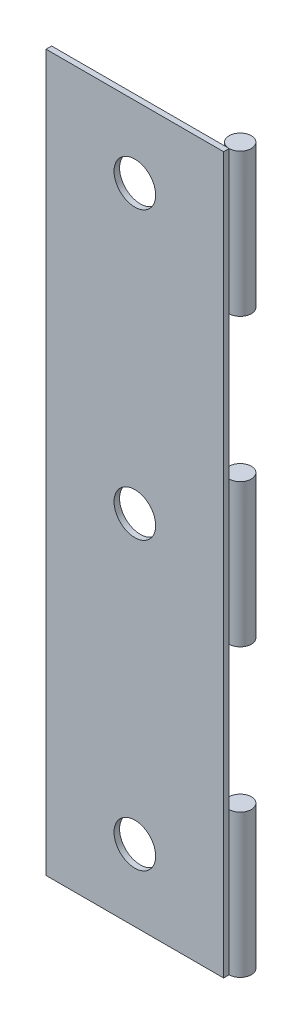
SolidWorks part; units mm, degrees
ref_plane "Front Plane" through (0, 0, 0) normal (0, 0, 1) x (1, 0, 0)
ref_plane "Top Plane" through (0, 0, 0) normal (0, 1, 0) x (1, 0, 0)
ref_plane "Right Plane" through (0, 0, 0) normal (1, 0, 0) x (0, 0, -1)
sketch "Sketch2" plane through (0, 0, 0) normal (0, 1, 0) x (1, 0, 0)
  circle A0 centre (0, 0) radius 1
extrude "Boss-Extrude1" add sketch "Sketch2" along normal blind 64.5
sketch "Sketch3" plane through (0, 0, 0) normal (0, 0, 1) x (1, 0, 0)
  line L0 (0, 64.5) -> (0, 51.6) construction
  line L1 (1, 64.5) -> (-1, 64.5) construction
  line L2 (0.0429, 38.7) -> (0.0429, 25.8) construction
  line L3 (-3.0046, 51.6) -> (3.0905, 51.6)
  line L4 (-3.0046, 51.6) -> (-3.0046, 38.7)
  line L5 (-3.0046, 38.7) -> (3.0905, 38.7)
  line L6 (3.0905, 51.6) -> (3.0905, 38.7)
  line L8 (-3.0046, 25.8) -> (3.0905, 25.8)
  line L9 (-3.0046, 25.8) -> (-3.0046, 12.9)
  line L10 (-3.0046, 12.9) -> (3.0905, 12.9)
  line L11 (3.0905, 25.8) -> (3.0905, 12.9)
  dimension "D1" = 12.9
  dimension "D2" = 12.9
extrude "Cut-Extrude1" cut sketch "Sketch3" against normal up to next and the other way up to next
sketch "Sketch4" plane through (0, 0, 0) normal (0, -1, 0) x (-1, 0, 0)
  line L1 (0, -1) -> (16, -1)
  line L2 (0, -1) -> (0, -1.5)
  line L3 (0, -1.5) -> (16, -1.5)
  line L4 (16, -1) -> (16, -1.5)
  circle A0 centre (0, 0) radius 1 construction
  dimension "D1" = 16
  dimension "D2" = 0.5
extrude "Boss-Extrude2" add sketch "Sketch4" against normal up to surface (64.5 mm away)
sketch "Sketch5" plane through (0, 0, 1) normal (0, 0, -1) x (-1, 0, 0)
  line L0 (0, 0) -> (0, 12.9) construction
  line L1 (0, 64.5) -> (0, 0) construction
  line L2 (0, 6.45) -> (16, 6.45) construction
  line L3 (16, 64.5) -> (16, 0) construction
  line L4 (0, 32.25) -> (16, 32.25) construction
  line L5 (0, 51.5953) -> (0, 64.5) construction
  line L6 (0, 58.0477) -> (16, 58.0477) construction
  circle A0 centre (8, 32.25) radius 1.875
  circle A1 centre (8, 6.45) radius 1.875
  circle A2 centre (8, 58.0477) radius 1.875
  dimension "D1" = 3.75
extrude "Cut-Extrude2" cut sketch "Sketch5" against normal up to next (0.5 mm away)
